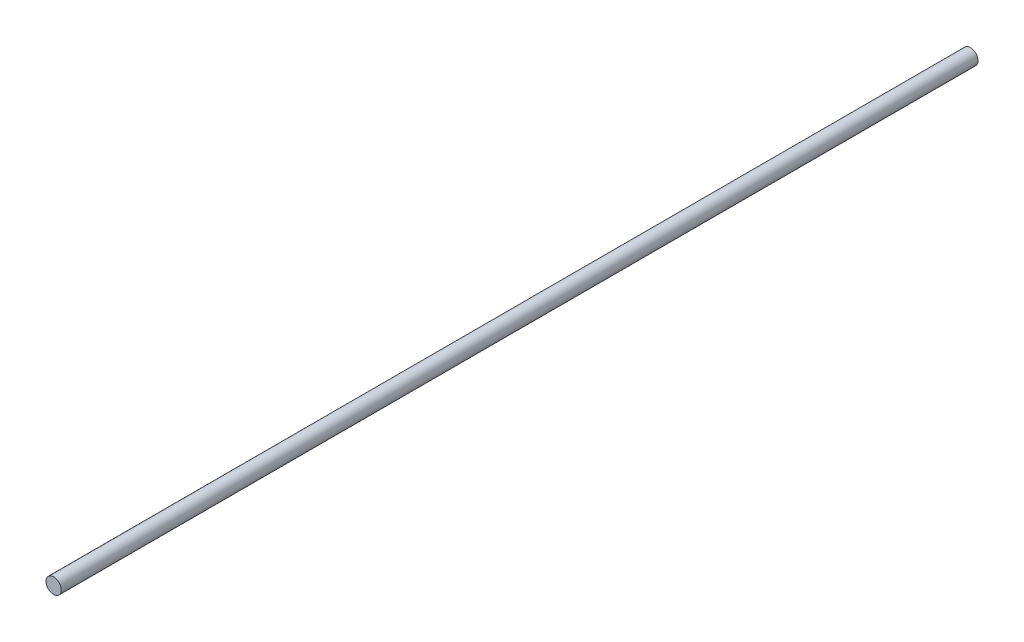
SolidWorks part; units mm, degrees
ref_plane "Alzado" through (0, 0, 0) normal (0, 0, 1) x (1, 0, 0)
ref_plane "Planta" through (0, 0, 0) normal (0, 1, 0) x (1, 0, 0)
ref_plane "Vista lateral" through (0, 0, 0) normal (1, 0, 0) x (0, 0, -1)
sketch "Croquis1" plane through (0, 0, 0) normal (0, 0, 1) x (1, 0, 0)
  circle A0 centre (0, 0) radius 2.5
  dimension "D1" = 5
extrude "Saliente-Extruir1" add sketch "Croquis1" along normal blind 300
